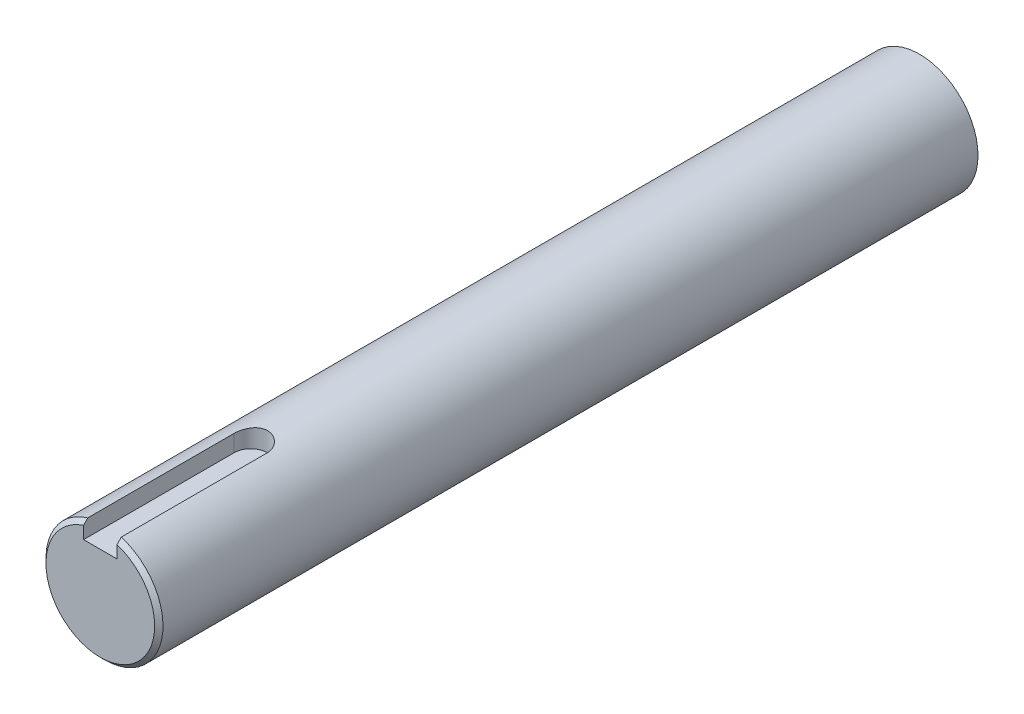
SolidWorks part; units mm, degrees
ref_plane "前视基准面" through (0, 0, 0) normal (0, 0, 1) x (1, 0, 0)
ref_plane "上视基准面" through (0, 0, 0) normal (0, 1, 0) x (1, 0, 0)
ref_plane "右视基准面" through (0, 0, 0) normal (1, 0, 0) x (0, 0, -1)
sketch "草图1" plane through (0, 0, 0) normal (0, 0, 1) x (1, 0, 0)
  line L0 (2, 4.7) -> (-2, 4.7)
  line L1 (0, 11.0283) -> (0, -13.3285) construction
  line L3 (2, 4.7) -> (2, 6.7082)
  line L4 (-2, 4.7) -> (-2, 6.7082)
  arc A0 (-2, 6.7082) -> (2, 6.7082) centre (0, 0) ccw
  dimension "D1" = 14
  dimension "D2" = 4.7
extrude "凸台-拉伸1" add sketch "草图1" along normal blind 98
sketch "草图2" plane through (0, 0, 0) normal (0, 0, -1) x (-1, 0, 0)
  circle A0 centre (0, 0) radius 7
  dimension "D1" = 14
extrude "凸台-拉伸4" add sketch "草图2" against normal blind 80
sketch "草图6" plane through (0, 4.7, 0) normal (0, 1, 0) x (1, 0, 0)
  line L0 (-2, -80) -> (-2, -98) construction
  line L1 (-2, -80) -> (2, -80)
  arc A0 (2, -80) -> (-2, -80) centre (0, -80) ccw
extrude "切除-拉伸20" cut sketch "草图6" along normal blind 80
chamfer "倒角1" distance 0.5 angle 45 1 edges at (0, -7, 98)
